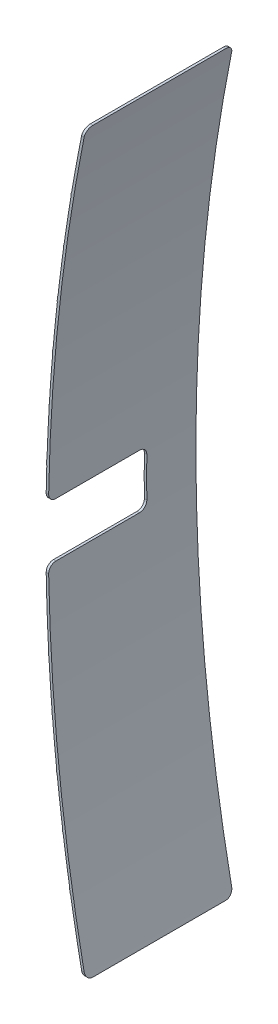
SolidWorks part; units mm, degrees
ref_plane "前视基准面" through (0, 0, 0) normal (0, 0, 1) x (1, 0, 0)
ref_plane "上视基准面" through (0, 0, 0) normal (0, 1, 0) x (1, 0, 0)
ref_plane "右视基准面" through (0, 0, 0) normal (1, 0, 0) x (0, 0, -1)
sketch "草图1" plane through (0, 0, 0) normal (0, 0, 1) x (1, 0, 0)
  line L0 (-73.5868, 15) -> (-73.4847, 15)
  line L1 (-73.5868, -15) -> (-73.4847, -15)
  line L2 (-1000, 0) -> (49000, 0) construction
  arc A0 (-73.5868, 15) -> (-73.5868, -15) centre (0, 0) ccw
  arc A1 (-73.4847, 15) -> (-73.4847, -15) centre (0, 0) ccw
  dimension "D1" = 150.2
  dimension "D2" = 150
  dimension "D3" = 30
extrude "凸台-拉伸1" add sketch "草图1" along normal blind 6
ref_plane "基准面1" through (-50, 0, 0) normal (1, 0, 0) x (0, 0, -1)
sketch "草图4" plane through (0, 0, 0) normal (1, 0, 0) x (0, 0, -1)
  line L0 (-6, -1.1) -> (-2, -1.1)
  line L1 (-6, 15) -> (-6, -15) construction
  line L2 (-2, -1.1) -> (-2, 1.1)
  line L3 (-2, 1.1) -> (-6, 1.1)
  line L4 (-6, 1.1) -> (-6, -1.1)
  line L5 (-1000, 0) -> (49000, 0) construction
  dimension "D1" = 4
  dimension "D2" = 2.2
extrude "切除-拉伸1" cut sketch "草图4" against normal through all
fillet "圆角1" radius 0.3 8 edges at (-73.5357, -15, 6) (-73.5357, -15, 0) (-73.5357, 15, 6) (-73.5357, 15, 0) (-75.0419, -1.1, 2) (-75.0419, 1.1, 2) (-75.0419, 1.1, 6) (-75.0419, -1.1, 6)
sketch "草图5" plane through (-50, 0, 0) normal (1, 0, 0) x (0, 0, -1)
  line L0 (0, -2.8572) -> (0, 3.1428)
  line L1 (0, 3.1428) -> (-2, 0.1428)
  line L2 (-2, 0.1428) -> (0, -2.8572)
  line L3 (-1002, 0.1428) -> (48998, 0.1428) construction
  line L4 (0, -14.7) -> (0, 14.7) construction
  line L5 (-2, 0.8) -> (-2, -0.8) construction
  line L6 (-6, -1.4) -> (-6, -14.7) construction
  line L7 (-6, -2.3) -> (-2, -2.3)
  line L8 (-6, -2.3) -> (-6, -2.1)
  line L9 (-6, -2.1) -> (-2, -2.1)
  line L10 (-2, -2.3) -> (-2, -2.1)
  line L11 (-6, -4.3) -> (-2, -4.3)
  line L12 (-6, -4.3) -> (-6, -4.1)
  line L13 (-6, -4.1) -> (-2, -4.1)
  line L14 (-2, -4.3) -> (-2, -4.1)
  line L15 (-6, -6.3) -> (-2, -6.3)
  line L16 (-6, -6.3) -> (-6, -6.1)
  line L17 (-6, -6.1) -> (-2, -6.1)
  line L18 (-2, -6.3) -> (-2, -6.1)
  line L19 (-6, -8.3) -> (-2, -8.3)
  line L20 (-6, -8.3) -> (-6, -8.1)
  line L21 (-6, -8.1) -> (-2, -8.1)
  line L22 (-2, -8.3) -> (-2, -8.1)
  line L23 (-6, -10.3) -> (-2, -10.3)
  line L24 (-6, -10.3) -> (-6, -10.1)
  line L25 (-6, -10.1) -> (-2, -10.1)
  line L26 (-2, -10.3) -> (-2, -10.1)
  line L27 (-6, -12.3) -> (-2, -12.3)
  line L28 (-6, -12.3) -> (-6, -12.1)
  line L29 (-6, -12.1) -> (-2, -12.1)
  line L30 (-2, -12.3) -> (-2, -12.1)
  line L31 (-5.7, -1.1) -> (-2.3, -1.1) construction
  line L32 (-2, 12.5855) -> (-2, 12.3855)
  line L33 (-6, 12.3855) -> (-2, 12.3855)
  line L34 (-6, 12.5855) -> (-6, 12.3855)
  line L35 (-6, 12.5855) -> (-2, 12.5855)
  line L36 (-2, 10.5855) -> (-2, 10.3855)
  line L37 (-6, 10.3855) -> (-2, 10.3855)
  line L38 (-6, 10.5855) -> (-6, 10.3855)
  line L39 (-6, 10.5855) -> (-2, 10.5855)
  line L40 (-2, 8.5855) -> (-2, 8.3855)
  line L41 (-6, 8.3855) -> (-2, 8.3855)
  line L42 (-6, 8.5855) -> (-6, 8.3855)
  line L43 (-6, 8.5855) -> (-2, 8.5855)
  line L44 (-2, 6.5855) -> (-2, 6.3855)
  line L45 (-6, 6.3855) -> (-2, 6.3855)
  line L46 (-6, 6.5855) -> (-6, 6.3855)
  line L47 (-6, 6.5855) -> (-2, 6.5855)
  line L48 (-2, 4.5855) -> (-2, 4.3855)
  line L49 (-6, 4.3855) -> (-2, 4.3855)
  line L50 (-6, 4.5855) -> (-6, 4.3855)
  line L51 (-6, 4.5855) -> (-2, 4.5855)
  line L52 (-2, 2.5855) -> (-2, 2.3855)
  line L53 (-6, 2.3855) -> (-2, 2.3855)
  line L54 (-6, 2.5855) -> (-6, 2.3855)
  line L55 (-6, 2.5855) -> (-2, 2.5855)
  dimension "D1" = 6
  dimension "D2" = 0.2
  dimension "D3" = 4
  dimension "D5" = 1
  dimension "D4" = 6
wrap "包覆1" sketch "草图5" wrap type emboss source sketch "草图5" thickness 0.01 parameters "D1"=0.01
